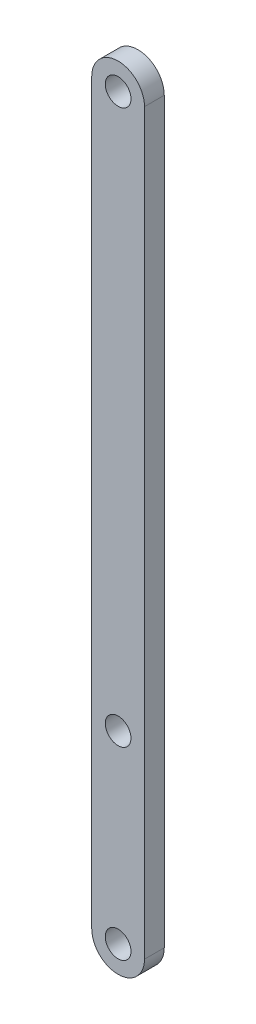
SolidWorks part; units mm, degrees
ref_plane "前视基准面" through (0, 0, 0) normal (0, 0, 1) x (1, 0, 0)
ref_plane "上视基准面" through (0, 0, 0) normal (0, 1, 0) x (1, 0, 0)
ref_plane "右视基准面" through (0, 0, 0) normal (1, 0, 0) x (0, 0, -1)
sketch "草图1" plane through (0, 0, 0) normal (0, 0, 1) x (1, 0, 0)
  line L0 (0, 0) -> (0, 112) construction
  line L1 (-4, 0) -> (-4, 112)
  line L2 (4, 0) -> (4, 112)
  arc A0 (-4, 0) -> (4, 0) centre (0, 0) ccw
  arc A1 (4, 112) -> (-4, 112) centre (0, 112) ccw
  point P3 (0, 56)
  dimension "D1" = 4
  dimension "D2" = 112
extrude "凸台-拉伸1" add sketch "草图1" along normal blind 3
hole_wizard "Ø3.9 (3.9) 直径孔1" positions "草图2" profile "草图3" hole size "Ø3.9" standard "GB"
sketch "草图2" plane through (0, 0, 3) normal (0, 0, 1) x (1, 0, 0)
  line L0 (0, 112) -> (0, 0) construction
  point P0 (0, 112)
  point P3 (0, 0)
  point P12 (0, 28)
  dimension "D1" = 28
sketch "草图3" plane through (0, 112, 3) normal (1, 0, 0) x (0, -1, 0)
  line L0 (0, 0) -> (0, 3)
  line L1 (0, 3) -> (1.95, 3)
  line L2 (1.95, 3) -> (1.95, 0)
  line L5 (1.95, 0) -> (0, 0)
  line L11 (0, -6.35) -> (0, 107.95) construction
  dimension "通孔孔直径" = 3.9
  dimension "通孔孔深度" = 3
